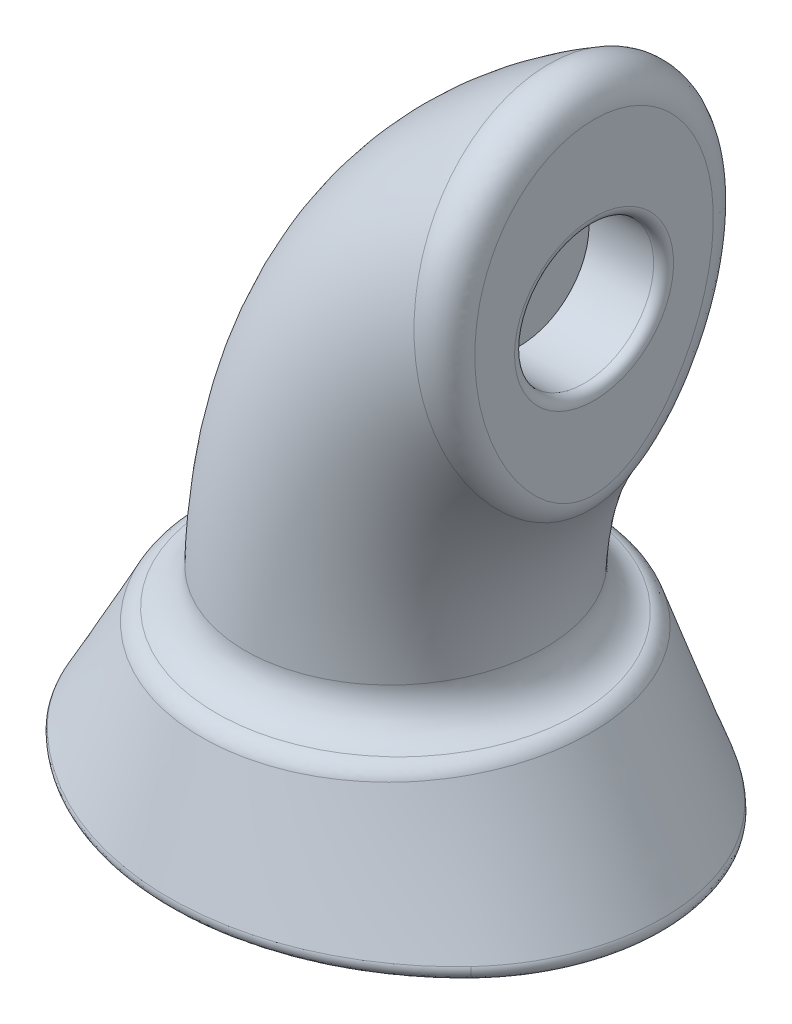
SolidWorks part; units mm, degrees
ref_plane "Front Plane" through (0, 0, 0) normal (0, 0, 1) x (1, 0, 0)
ref_plane "Top Plane" through (0, 0, 0) normal (0, 1, 0) x (1, 0, 0)
ref_plane "Right Plane" through (0, 0, 0) normal (1, 0, 0) x (0, 0, -1)
sketch "Sketch1" plane through (0, 0, 0) normal (0, 1, 0) x (1, 0, 0)
  circle A0 centre (0, 0) radius 38.1
  dimension "D1" = 76.2
sketch "Sketch2" plane through (0, 0, 0) normal (0, 0, 1) x (1, 0, 0)
  line L0 (0, 0) -> (0, 5.0755)
  line L1 (0, 0) -> (0, 113.2569) construction
  arc A1 (0, 5.0755) -> (67.6942, 112.2822) centre (118.7382, 5.0755) cw
sweep "Sweep1" add profiles "Sketch1" path "Sketch2"
sketch "Sketch4" plane through (0, 0, 0) normal (0, -1, 0) x (1, 0, 0)
  circle A0 centre (0, 0) radius 48.4119
sketch "Sketch6" plane through (0, 0, 0) normal (0, 0, 1) x (1, 0, 0)
  line L0 (95.487, 162.6541) -> (95.487, 35.9847)
  line L1 (95.487, 35.9847) -> (50.7877, 35.9847)
  line L2 (50.7877, 35.9847) -> (50.7877, 162.6541)
  line L3 (50.7877, 162.6541) -> (95.487, 162.6541)
extrude "Cut-Extrude2" cut sketch "Sketch6" against normal through all and the other way through all
ref_plane "Plane1" through (0, -38.1, 0) normal (0, -1, 0) x (1, 0, 0)
sketch "Sketch5" plane through (0, -38.1, 0) normal (0, -1, 0) x (1, 0, 0)
  line L0 (0, 0) -> (85.2674, 0) construction
  arc A0 (-55.0055, 36.1843) -> (55.3989, 36.1843) centre (0.1967, -19.8362) cw
  arc A1 (-55.0055, -36.1843) -> (55.3989, -36.1843) centre (0.1967, 19.8362) ccw
  arc A2 (-55.0055, -36.1843) -> (-55.0055, 36.1843) centre (-19.3498, 0) cw
  arc A3 (55.3989, -36.1843) -> (55.3989, 36.1843) centre (19.7432, 0) ccw
  point P9 (-75.9092, 0)
  point P12 (76.3026, 0)
  dimension "D1" = 50.8
loft "Loft1" add profiles "Sketch4", "Sketch5"
sketch "Sketch7" plane through (50.7877, 0, 0) normal (-1, 0, 0) x (0, 0, 1)
  circle A0 centre (0, 91.8103) radius 17.7746
extrude "Cut-Extrude3" cut sketch "Sketch7" along normal blind 19.05
fillet "Fillet1" radius 2.54 5 edges at (50.7877, 91.8103, 17.7746)
fillet "Fillet2" radius 5.08 1 edges at (-45.5136, 0, -16.505)
fillet "Fillet3" radius 10.16 3 edges at (0, 0, 38.1) (0, 5.0755, 38.1) (-34.8612, 0, -28.5161)
fillet "Fillet4" radius 7.62 1 edges at (50.7877, 128.3627, 31.0819)
